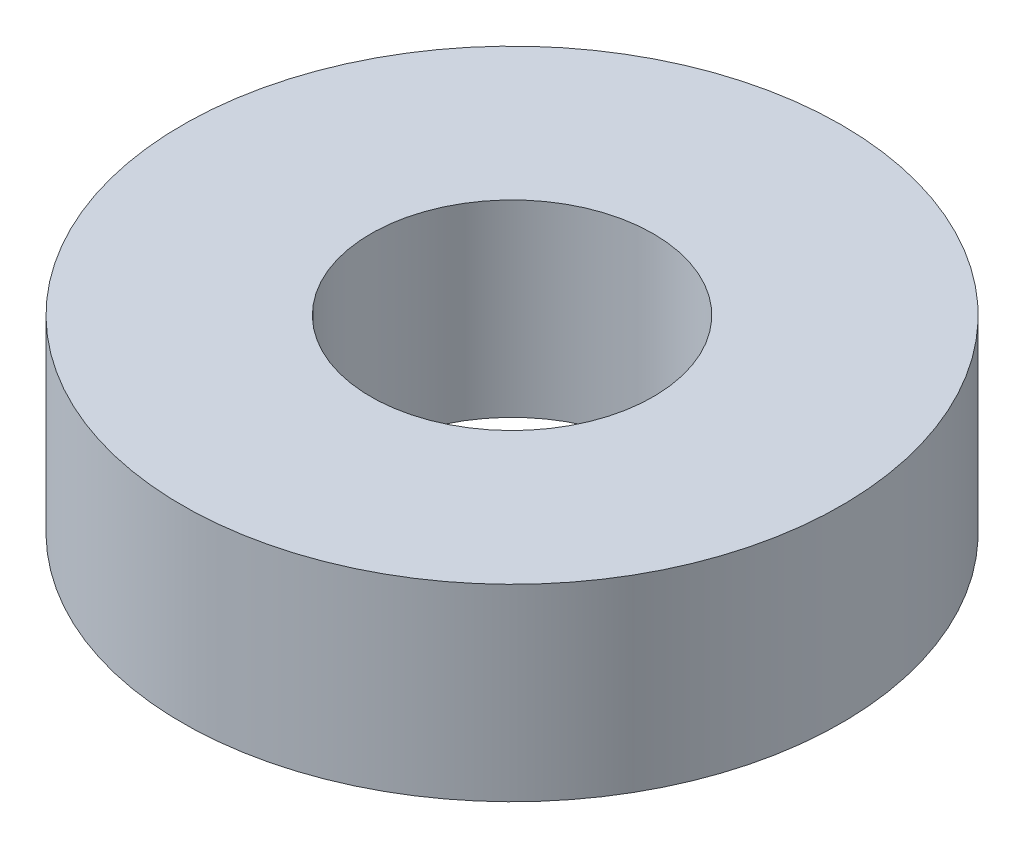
SolidWorks part; units mm, degrees
ref_plane "Front Plane" through (0, 0, 0) normal (0, 0, 1) x (1, 0, 0)
ref_plane "Top Plane" through (0, 0, 0) normal (0, 1, 0) x (1, 0, 0)
ref_plane "Right Plane" through (0, 0, 0) normal (1, 0, 0) x (0, 0, -1)
sketch "Sketch1" plane through (0, 0, 0) normal (0, 0, 1) x (1, 0, 0)
  line L0 (0, 0) -> (0, 3.6463) construction
  line L1 (-6, 3.9377) -> (-14, 3.9377)
  line L2 (-14, 3.9377) -> (-14, 0)
  line L3 (-14, -4.0623) -> (-6, -4.0623)
  line L4 (-0.2309, 0) -> (-3592.4303, 0) construction
  line L5 (-14, 0) -> (-14, -4.0623)
  line L6 (14, -4.0623) -> (6, -4.0623) construction
  line L7 (14, 0) -> (14, -4.0623) construction
  line L8 (14, 3.9377) -> (14, 0) construction
  line L9 (6, 3.9377) -> (14, 3.9377) construction
  line L10 (-6, 3.9377) -> (-6, -4.0623)
  line L11 (6, -4.0623) -> (6, 3.9377) construction
  dimension "D1" = 8
  dimension "D2" = 12
  dimension "D3" = 28
revolve "Revolve1" add sketch "Sketch1" angle 360 about L0
